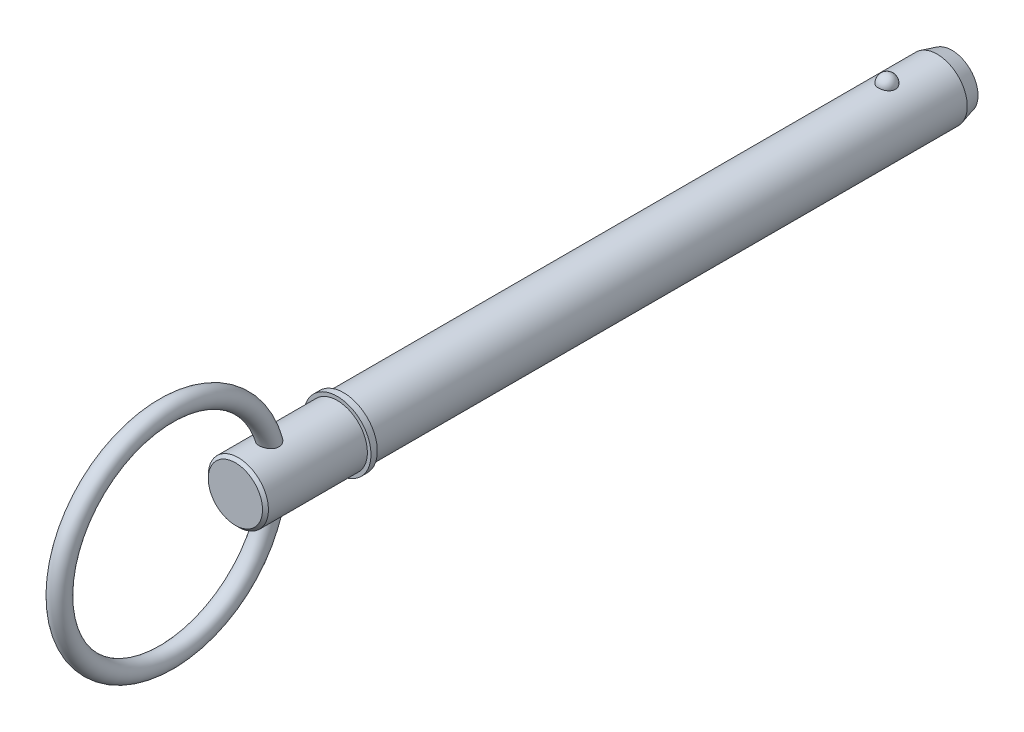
SolidWorks part; units mm, degrees
ref_plane "Front Plane" through (0, 0, 0) normal (0, 0, 1) x (1, 0, 0)
ref_plane "Top Plane" through (0, 0, 0) normal (0, 1, 0) x (1, 0, 0)
ref_plane "Right Plane" through (0, 0, 0) normal (1, 0, 0) x (0, 0, -1)
sketch "Sketch2" plane through (0, 0, 0) normal (0, 0, 1) x (1, 0, 0)
  circle A0 centre (0, 0) radius 7.145
  point P3 (0, 7.145)
  dimension "D1" = 14.29
extrude "Boss-Extrude1" add sketch "Sketch2" along normal blind 127
sketch "Sketch3" plane through (0, 0, 0) normal (0, 0, -1) x (-1, 0, 0)
  circle A0 centre (0, 0) radius 7.145
  dimension "D1" = 14.29
extrude "Boss-Extrude2" add sketch "Sketch3" along normal blind 17.45
chamfer "Chamfer1" distance 3.5 angle 15 1 edges at (-7.145, 0, -17.45)
sketch "Sketch18" plane through (0, 0, 0) normal (1, 0, 0) x (0, 0, -1)
  line L0 (13.95, 7.145) -> (-127, 7.145) construction
  line L1 (2.02, 9.165) -> (2.02, 5.125)
  line L2 (-127, -7.145) -> (13.95, -7.145) construction
  arc A0 (2.02, 9.165) -> (2.02, 5.125) centre (2.02, 7.145) ccw
  point P4 (0, 7.145)
  dimension "D1" = 16.31
revolve "Revolve1" add sketch "Sketch18" angle 360 about L1
sketch "Sketch19" plane through (0, 0, 0) normal (1, 0, 0) x (0, 0, -1)
  line L0 (-33.7288, 0) -> (-46.4542, 0) construction
sketch "Sketch20" plane through (0, 0, 0) normal (1, 0, 0) x (0, 0, -1)
  line L0 (-127, 0) -> (-127, 8)
  line L1 (-127, 7.145) -> (-127, -7.145) construction
  line L2 (-127, 8) -> (-128.5, 8)
  line L3 (-128.5, 8) -> (-128.5, 0)
  line L4 (-33.7288, 0) -> (-46.4542, 0) construction
  line L5 (-128.5, 0) -> (-127, 0)
  dimension "D1" = 8
  dimension "D2" = 1.5
revolve "Revolve2" add sketch "Sketch20" angle 360 about L0
sketch "Sketch21" plane through (0, 0, 127) normal (0, 0, -1) x (-1, 0, 0)
  circle A0 centre (0, 0) radius 7.145
  dimension "D1" = 14.29
extrude "Boss-Extrude3" add sketch "Sketch21" against normal blind 25.7
chamfer "Chamfer2" distance 0.7 angle 45 1 edges at (-7.145, 0, 152.7)
sketch "Sketch23" plane through (0, 0, 0) normal (1, 0, 0) x (0, 0, -1)
  line L0 (-152.7, 6.445) -> (-152.7, -6.445) construction
  circle A0 centre (-169.1, 0) radius 25.4
  point P2 (-143.7, 0)
  dimension "D1" = 50.8
  dimension "D2" = 9
sketch "Sketch24" plane through (0, 0, 0) normal (0, 1, 0) x (1, 0, 0)
  circle A0 centre (0, -143.7) radius 2.25
  dimension "D1" = 4.5
sweep "Sweep1" add profiles "Sketch24" path "Sketch23"
